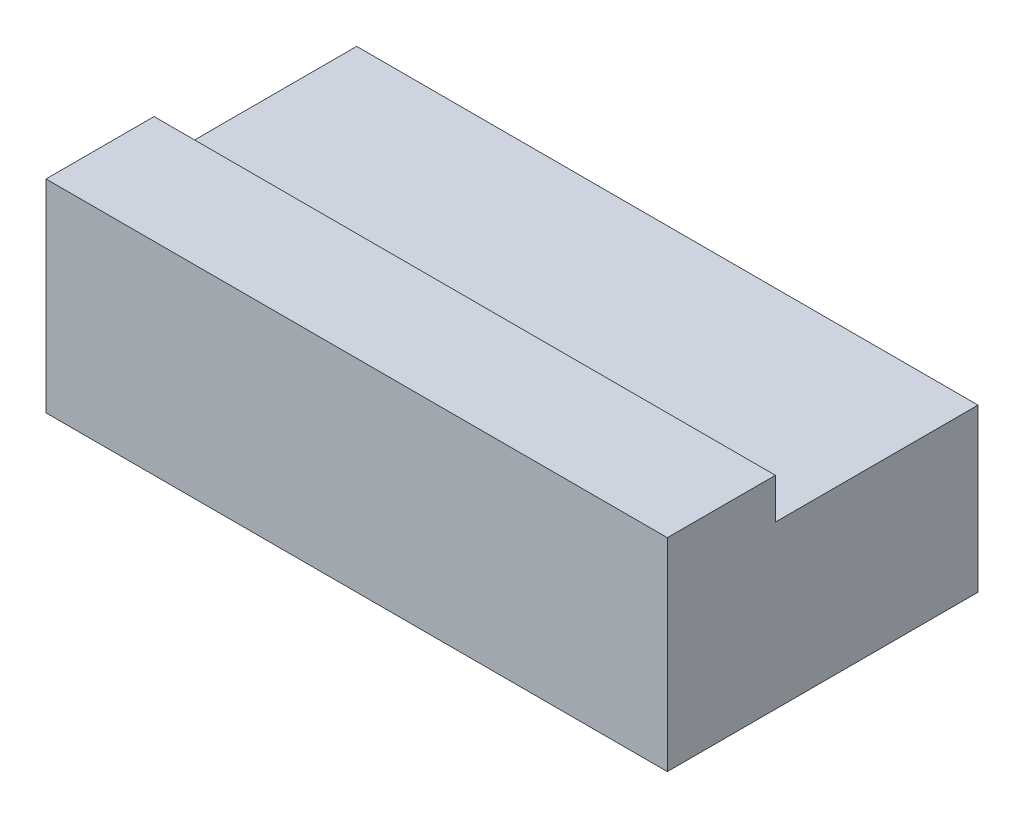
SolidWorks part; units mm, degrees
ref_plane "Front Plane" through (0, 0, 0) normal (0, 0, 1) x (1, 0, 0)
ref_plane "Top Plane" through (0, 0, 0) normal (0, 1, 0) x (1, 0, 0)
ref_plane "Right Plane" through (0, 0, 0) normal (1, 0, 0) x (0, 0, -1)
sketch "Sketch1" plane through (0, 0, 0) normal (0, 1, 0) x (1, 0, 0)
  line L1 (-115, 57.5) -> (115, 57.5)
  line L2 (-115, 57.5) -> (-115, -57.5)
  line L3 (-115, -57.5) -> (115, -57.5)
  line L4 (115, 57.5) -> (115, -57.5)
  line L5 (-115, 57.5) -> (115, -57.5) construction
  line L6 (-115, -57.5) -> (115, 57.5) construction
  point P0 (0, 0)
  dimension "D1" = 230
  dimension "D2" = 115
extrude "Boss-Extrude1" add sketch "Sketch1" along normal mid plane 75
sketch "Sketch5" plane through (0, 37.5, 0) normal (0, 1, 0) x (1, 0, 0)
  line L0 (115, -57.5) -> (115, 57.5) construction
  line L1 (-115, 57.5) -> (115, 57.5)
  line L2 (-115, 57.5) -> (-115, -17.5)
  line L3 (-115, -17.5) -> (115, -17.5)
  line L4 (115, 57.5) -> (115, -17.5)
  dimension "D1" = 75
extrude "Cut-Extrude4" cut sketch "Sketch5" against normal blind 15
